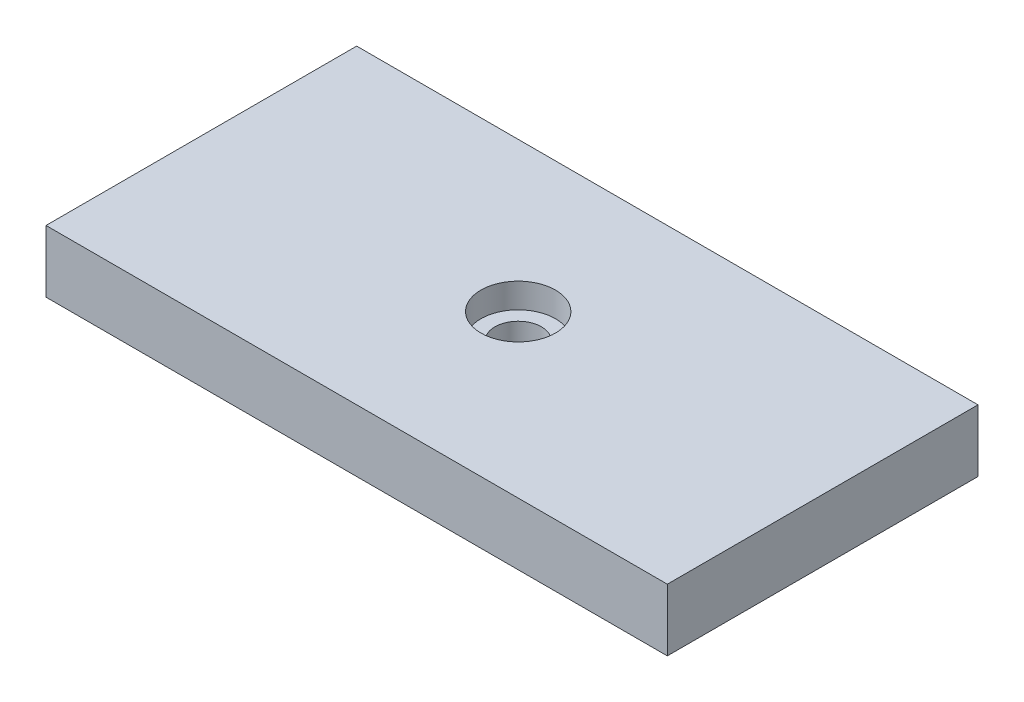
SolidWorks part; units mm, degrees
ref_plane "Front Plane" through (0, 0, 0) normal (0, 0, 1) x (1, 0, 0)
ref_plane "Top Plane" through (0, 0, 0) normal (0, 1, 0) x (1, 0, 0)
ref_plane "Right Plane" through (0, 0, 0) normal (1, 0, 0) x (0, 0, -1)
sketch "Sketch1" plane through (0, 0, 0) normal (0, 1, 0) x (1, 0, 0)
  line L1 (0, 0) -> (100, 0)
  line L2 (0, 0) -> (0, 50)
  line L3 (0, 50) -> (100, 50)
  line L4 (100, 0) -> (100, 50)
  dimension "D1" = 100
  dimension "D2" = 50
extrude "Extrude1" add sketch "Sketch1" along normal blind 10
hole_wizard "CBORE for M3 SBHCS1" positions "3DSketch1" profile "Sketch2" counterbore size "M3" standard "ANSI Metric"
sketch3d "3DSketch1"
  line L0 (0, 10, -50) -> (0, 10, 0) construction
  line L1 (100, 10, -50) -> (0, 10, -50) construction
  point P0 (50, 10, -26)
  dimension "D1" = 50
  dimension "D2" = 24
sketch "Sketch2" plane through (50, 10, -26) normal (1, 0, 0) x (0, 0, 1)
  line L0 (0, 0) -> (0, 10)
  line L1 (0, 10) -> (3.75, 10)
  line L3 (3.75, 10) -> (3.75, 4)
  line L4 (3.75, 4) -> (6, 4)
  line L5 (6, 4) -> (6, 0)
  line L7 (6, 0) -> (0, 0)
  line L11 (0, -6.35) -> (0, 107.95) construction
  dimension "Thru Hole Dia." = 7.5
  dimension "Thru Hole Depth" = 10
  dimension "C'Bore Dia." = 12
  dimension "C'Bore Depth" = 4
